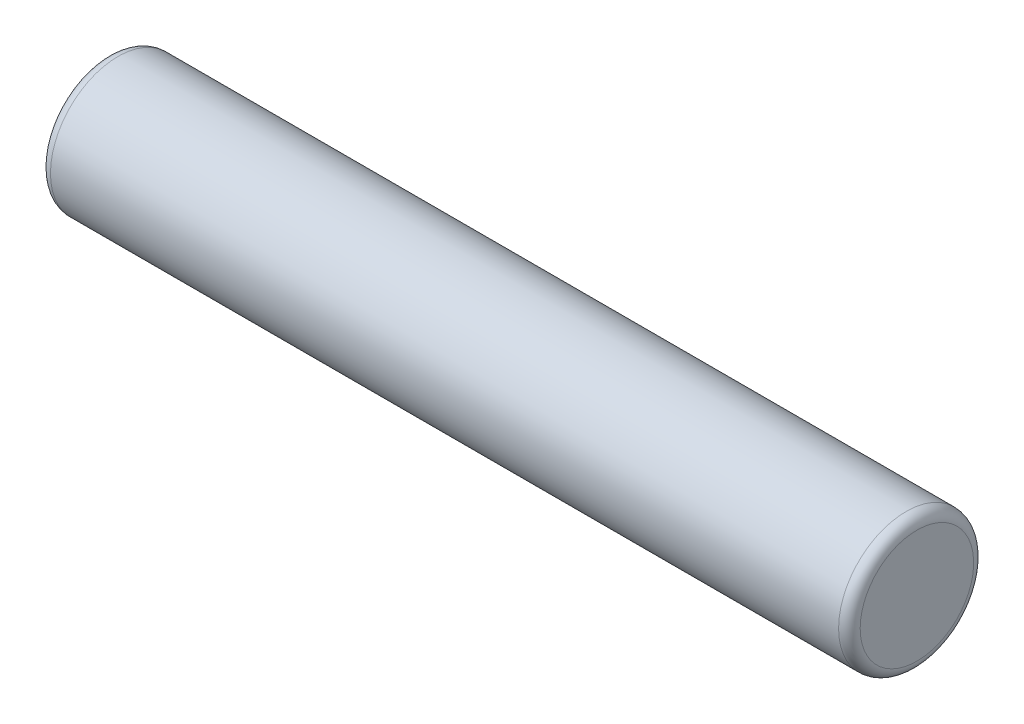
SolidWorks part; units mm, degrees
ref_plane "Plane1" through (0, 0, 0) normal (0, 0, 1) x (1, 0, 0)
ref_plane "Plane2" through (0, 0, 0) normal (0, 1, 0) x (1, 0, 0)
ref_plane "Plane3" through (0, 0, 0) normal (1, 0, 0) x (0, 0, -1)
sketch "Sketch1" plane through (0, 0, 0) normal (0, 0, 1) x (1, 0, 0)
  line L1 (-6.35, 0) -> (47.0909, 0) construction
  line L2 (0, 0) -> (38.1, 0)
  line L3 (38.1, 0) -> (38.1, 2.6695)
  line L5 (37.592, 3.1775) -> (0.508, 3.1775)
  line L6 (0, 2.6695) -> (0, 0)
  arc A0 (0.508, 3.1775) -> (0, 2.6695) centre (0.508, 2.6695) ccw
  arc A1 (38.1, 2.6695) -> (37.592, 3.1775) centre (37.592, 2.6695) ccw
  point P8 (0, 3.1775)
  point P11 (38.1, 3.1775)
  dimension "D1" = 0.508
  dimension "Diameter" = 6.3551
  dimension "Length" = 38.1
revolve "Base-Revolve" add sketch "Sketch1" angle 360 about L1
